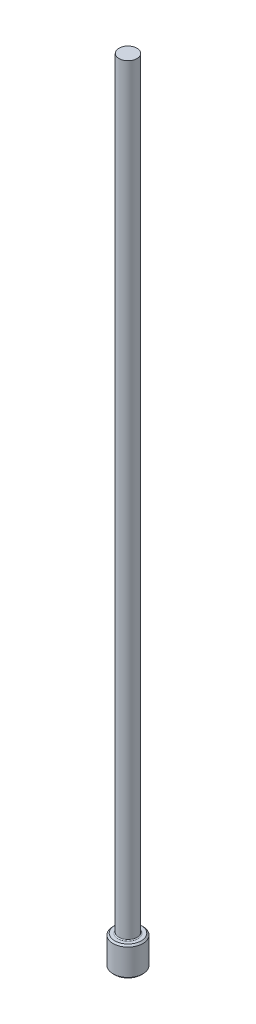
SolidWorks part; units mm, degrees
ref_plane "Front Plane" through (0, 0, 0) normal (0, 0, 1) x (1, 0, 0)
ref_plane "Top Plane" through (0, 0, 0) normal (0, 1, 0) x (1, 0, 0)
ref_plane "Right Plane" through (0, 0, 0) normal (1, 0, 0) x (0, 0, -1)
other "Configuration Table"
sketch "Sketch1" plane through (0, 0, 0) normal (0, 0, 1) x (1, 0, 0)
  line L0 (0, 259.9588) -> (0, -15.1925) construction
  line L1 (0, 0) -> (-1.1938, 0)
  line L2 (-1.1938, 0) -> (-1.1938, 2.3622)
  line L3 (-1.1938, 2.3622) -> (-0.7239, 2.3622)
  line L4 (-0.7239, 2.3622) -> (-0.7239, 63.5)
  line L5 (-0.7239, 63.5) -> (0, 63.5)
  line L6 (0, 63.5) -> (0, 0)
  dimension "L" = 63.5
  dimension "H" = 2.3876
  dimension "T" = 2.3622
  dimension "D" = 1.4478
revolve "Revolve1" add sketch "Sketch1" angle 360 about L0
chamfer "Chamfer1" distance 0.127 angle 45 2 edges at (0, 2.3622, 1.1938) (0, 0, 1.1938)
fillet "Fillet1" radius 0.0762 1 edges at (0, 2.3622, 0.7239)
